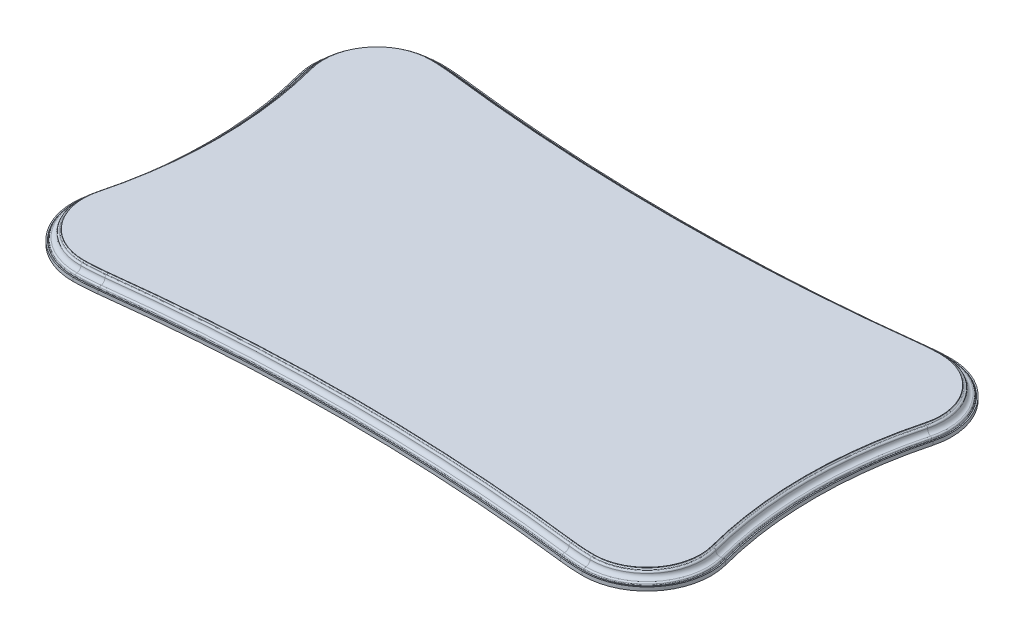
SolidWorks part; units mm, degrees
ref_plane "Alzado" through (0, 0, 0) normal (0, 0, 1) x (1, 0, 0)
ref_plane "Planta" through (0, 0, 0) normal (0, 1, 0) x (1, 0, 0)
ref_plane "Vista lateral" through (0, 0, 0) normal (1, 0, 0) x (0, 0, -1)
sketch "Croquis1" plane through (0, 0, 0) normal (0, 0, 1) x (1, 0, 0)
  line L0 (625, 12.5) -> (-625, -12.5) construction
  line L1 (-625, 12.5) -> (625, 12.5)
  line L2 (-625, 12.5) -> (-625, -12.5)
  line L3 (-625, -12.5) -> (625, -12.5)
  line L4 (625, 12.5) -> (625, -12.5)
extrude "Extruir1" add sketch "Croquis1" along normal mid plane 730
sketch "Croquis2" plane through (0, 12.5, 0) normal (0, 1, 0) x (1, 0, 0)
  line L0 (0, 0) -> (0, 435.6431) construction
  line L1 (0, 0) -> (824.5173, 0) construction
  line L2 (-615, 355) -> (-215.9232, 355) construction
  line L3 (-615, 355) -> (-615, -185.7176) construction
  line L4 (-585, 325) -> (460.3784, 325) construction
  line L5 (-585, 325) -> (-585, -140.4186) construction
  line L6 (625, 365) -> (-625, 365)
  line L7 (-625, 365) -> (-625, -365)
  line L8 (-625, -365) -> (625, -365)
  line L9 (625, -365) -> (625, 365)
  line L10 (625, 365) -> (-625, 365)
  line L11 (-625, 365) -> (-625, -365)
  line L12 (-625, -365) -> (625, -365)
  line L13 (625, -365) -> (625, 365)
  arc A0 (-445, 351.99) -> (445, 351.99) centre (0, 4006.981) ccw
  arc A1 (-610.9195, 200) -> (-610.9195, -200) centre (-1369.5783, 0) cw
  arc A2 (-445, 351.99) -> (-490, 354.9911) centre (-494.9731, -58.4625) ccw
  arc A3 (-610.9195, 200) -> (-490, 354.9911) centre (-491.4856, 231.4856) cw
  arc A4 (610.9195, 200) -> (490, 354.9911) centre (491.4856, 231.4856) ccw
  arc A5 (445, 351.99) -> (490, 354.9911) centre (494.9731, -58.4625) cw
  arc A6 (445, -351.99) -> (490, -354.9911) centre (494.9731, 58.4625) ccw
  arc A7 (610.9195, -200) -> (490, -354.9911) centre (491.4856, -231.4856) cw
  arc A8 (-610.9195, -200) -> (-490, -354.9911) centre (-491.4856, -231.4856) ccw
  arc A9 (-445, -351.99) -> (-490, -354.9911) centre (-494.9731, 58.4625) cw
  arc A10 (-445, -351.99) -> (445, -351.99) centre (0, -4006.981) cw
  arc A11 (610.9195, 200) -> (610.9195, -200) centre (1369.5783, 0) ccw
  dimension "D1" = 890
  dimension "D4" = 10
  dimension "D6" = 30
  dimension "D8" = 400
  dimension "D2" = 980
  dimension "D5" = 10
  dimension "D7" = 30
  dimension "D3" = 0
extrude "Cortar-Extruir1" cut sketch "Croquis2" against normal through all
sketch "Croquis3" plane through (0, 0, 0) normal (0, 0, 1) x (1, 0, 0)
  line L0 (-589, 14.5) -> (-564, 14.5)
  line L1 (-564, 14.5) -> (-564, 11.5)
  line L2 (-566, 9.5) -> (-567, 9.5)
  line L3 (-581.8423, -4.9863) -> (-582.7321, -5.5)
  line L4 (-589, -5.5) -> (-589, 14.5)
  line L5 (-582.7321, -5.5) -> (-589, -5.5)
  line L6 (-585, 42.2487) -> (-585, 12.5) construction
  line L7 (-585, 12.5) -> (-610.9195, 12.5) construction
  line L8 (-490, 12.5) -> (-615, 12.5) construction
  arc A0 (-567, 9.5) -> (-570, 6.5) centre (-567, 6.5) ccw
  arc A1 (-570, 6.5) -> (-578, -1.5) centre (-578, 6.5) cw
  arc A2 (-578, -1.5) -> (-580.9054, -3.7526) centre (-578, -4.5) ccw
  arc A3 (-580.9054, -3.7526) -> (-581.8423, -4.9863) centre (-582.8423, -3.2543) cw
  arc A4 (-564, 11.5) -> (-566, 9.5) centre (-566, 11.5) cw
  point P21 (-581, -4.5)
  point P24 (-564, 9.5)
  dimension "D1" = 5
  dimension "D5" = 3
  dimension "D10" = 2
  dimension "D2" = 30
  dimension "D3" = 3
  dimension "D4" = 25
  dimension "D6" = 20
  dimension "D7" = 8
  dimension "D8" = 4
  dimension "D9" = 2
sketch "Croquis4" plane through (0, 12.5, 0) normal (0, 1, 0) x (1, 0, 0)
  arc A12 (-445, 351.99) -> (-490, 354.9911) centre (-494.9731, -58.4625) ccw
  arc A13 (-490, 354.9911) -> (-610.9195, 200) centre (-491.4856, 231.4856) ccw
  arc A14 (-610.9195, -200) -> (-610.9195, 200) centre (-1369.5783, 0) ccw
  arc A15 (-610.9195, -200) -> (-490, -354.9911) centre (-491.4856, -231.4856) ccw
  arc A16 (-490, -354.9911) -> (-445, -351.99) centre (-494.9731, 58.4625) ccw
  arc A17 (445, -351.99) -> (-445, -351.99) centre (0, -4006.981) ccw
  arc A18 (445, -351.99) -> (490, -354.9911) centre (494.9731, 58.4625) ccw
  arc A19 (490, -354.9911) -> (610.9195, -200) centre (491.4856, -231.4856) ccw
  arc A20 (610.9195, 200) -> (610.9195, -200) centre (1369.5783, 0) ccw
  arc A21 (610.9195, 200) -> (490, 354.9911) centre (491.4856, 231.4856) ccw
  arc A22 (490, 354.9911) -> (445, 351.99) centre (494.9731, -58.4625) ccw
  arc A23 (-445, 351.99) -> (445, 351.99) centre (0, 4006.981) ccw
  arc A24 (-445, 351.99) -> (-490, 354.9911) centre (-494.9731, -58.4625) ccw
  arc A25 (-490, 354.9911) -> (-610.9195, 200) centre (-491.4856, 231.4856) ccw
  arc A26 (-610.9195, -200) -> (-610.9195, 200) centre (-1369.5783, 0) ccw
  arc A27 (-610.9195, -200) -> (-490, -354.9911) centre (-491.4856, -231.4856) ccw
  arc A28 (-490, -354.9911) -> (-445, -351.99) centre (-494.9731, 58.4625) ccw
  arc A29 (445, -351.99) -> (-445, -351.99) centre (0, -4006.981) ccw
  arc A30 (445, -351.99) -> (490, -354.9911) centre (494.9731, 58.4625) ccw
  arc A31 (490, -354.9911) -> (610.9195, -200) centre (491.4856, -231.4856) ccw
  arc A32 (610.9195, 200) -> (610.9195, -200) centre (1369.5783, 0) ccw
  arc A33 (610.9195, 200) -> (490, 354.9911) centre (491.4856, 231.4856) ccw
  arc A34 (490, 354.9911) -> (445, 351.99) centre (494.9731, -58.4625) ccw
  arc A35 (-445, 351.99) -> (445, 351.99) centre (0, 4006.981) ccw
  dimension "D1" = 0
sweep "Cortar-Barrer1" cut profiles "Croquis3" path "Croquis4"
